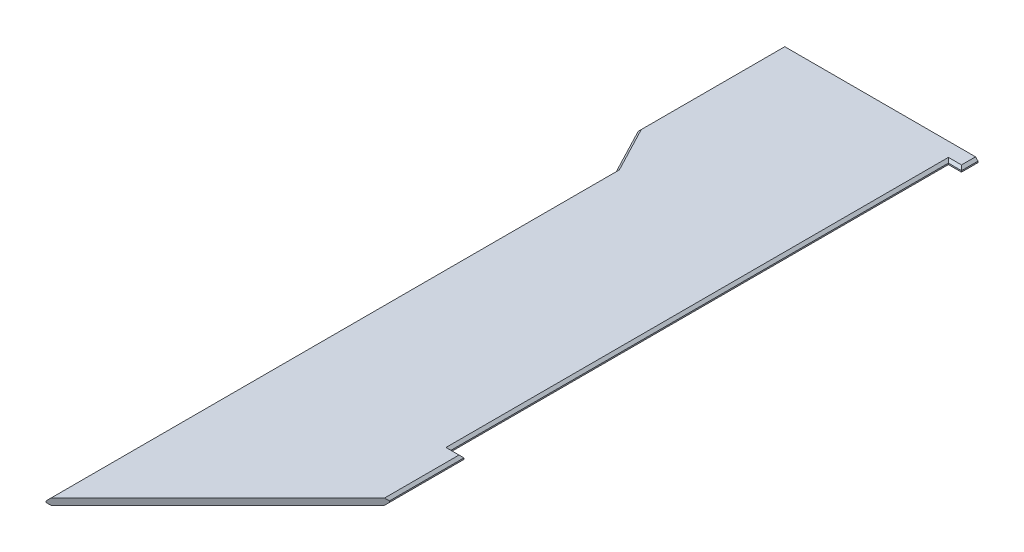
SolidWorks part; units mm, degrees
ref_plane "Front Plane" through (0, 0, 0) normal (1, 0, 0) x (0, 1, 0)
ref_plane "Top Plane" through (0, 0, 0) normal (0, 0, 1) x (0, 1, 0)
ref_plane "Right Plane" through (0, 0, 0) normal (0, 1, 0) x (-1, 0, 0)
sketch "Sketch2"
sketch_block_instance "Block4-1"
sketch_block "Block4" parameters "D1"=6, "D2"=6
extrude "Boss-Extrude2" add sketch "Sketch2" along normal mid plane 38.1
chamfer "Chamfer1" distance 15 angle 45 16 edges at (-487.0608, -19.05, 759.0185) (-559.6545, -19.05, -1106.1244) (-632.2483, -19.05, -1681.2829) (-487.0608, 19.05, 759.0185) (-559.6545, 19.05, -1106.1244) (-632.2483, 19.05, -1681.2829) (552.5517, -19.05, -2067.5462) (512.9517, -19.05, -2017.5462) (473.3517, -19.05, -511.5462) (512.9517, -19.05, 994.4538) (552.5517, -19.05, 1220.0538) (552.5517, 19.05, -2067.5462) (512.9517, 19.05, -2017.5462) (473.3517, 19.05, -511.5462) (512.9517, 19.05, 994.4538) (552.5517, 19.05, 1220.0538)
